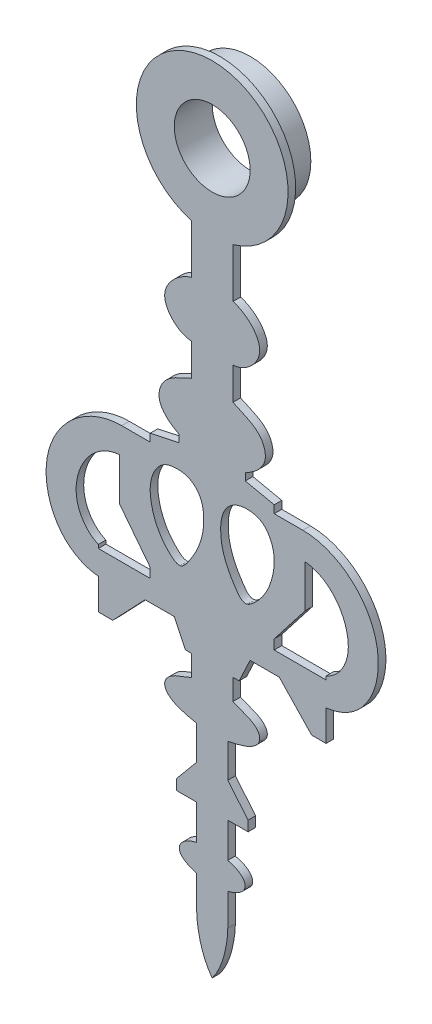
SolidWorks part; units mm, degrees
ref_plane "Спереди" through (0, 0, 0) normal (0, 0, 1) x (1, 0, 0)
ref_plane "Сверху" through (0, 0, 0) normal (0, 1, 0) x (1, 0, 0)
ref_plane "Справа" through (0, 0, 0) normal (1, 0, 0) x (0, 0, -1)
sketch "Эскиз1" plane through (0, 0, 0) normal (0, 0, 1) x (1, 0, 0)
  line L0 (2.735, 26.3813) -> (2.735, 32.8813)
  line L1 (2.05, -45.5133) -> (2.05, -41.28)
  line L2 (2.05, -37.7522) -> (2.05, -33.1537)
  line L3 (2.05, -33.1537) -> (4.7311, -33.1537)
  line L4 (4.7311, -33.1537) -> (4.7311, -31.8131)
  line L5 (4.7311, -31.8131) -> (2.05, -28.6028)
  line L6 (2.05, -28.6028) -> (2.05, -24.1578)
  line L7 (15.0106, -17.9279) -> (15.0106, -13.8567)
  line L8 (13.1058, -17.9279) -> (15.0106, -17.9279)
  line L9 (8.8372, -13.4476) -> (13.1058, -17.9279)
  line L10 (4.9919, -13.4476) -> (8.8372, -13.4476)
  line L11 (2.735, -16.5168) -> (3.5455, -16.5168)
  line L12 (3.5455, -16.5168) -> (4.9919, -13.4476)
  line L13 (2.735, -19.2684) -> (2.735, -16.5168)
  line L14 (11.9415, 4.8758) -> (8.1668, 4.8758)
  line L15 (8.1668, 4.8758) -> (8.1668, 5.8988)
  line L16 (8.1668, 5.8988) -> (4.3568, 6.7102)
  line L17 (2.735, 14.8805) -> (2.735, 19.1305)
  line L29 (-15.0106, -10.2211) -> (-15.0106, -10.6797)
  line L30 (-15.0106, -10.6797) -> (-8.1668, -10.6797)
  line L31 (-8.1668, -10.6797) -> (-8.1668, -9.4097)
  line L32 (-8.1668, -9.4097) -> (-12.2237, -4.1886)
  line L33 (-12.2237, -4.1886) -> (-12.2237, 1.4205)
  line L62 (4.3568, 6.7102) -> (4.3568, 7.6627)
  line L63 (15.0106, -10.2211) -> (15.0106, -10.6797)
  line L64 (15.0106, -10.6797) -> (8.1668, -10.6797)
  line L65 (8.1668, -10.6797) -> (8.1668, -9.4097)
  line L66 (8.1668, -9.4097) -> (12.2237, -4.1886)
  line L67 (12.2237, -4.1886) -> (12.2237, 1.4205)
  line L204 (-2.05, -45.5133) -> (-2.05, -41.28)
  line L218 (-2.05, -37.7522) -> (-2.05, -33.1537)
  line L219 (-2.05, -33.1537) -> (-4.7311, -33.1537)
  line L220 (-4.7311, -33.1537) -> (-4.7311, -31.8131)
  line L221 (-4.7311, -31.8131) -> (-2.05, -28.6028)
  line L222 (-2.05, -28.6028) -> (-2.05, -24.1578)
  line L240 (-2.735, -19.2684) -> (-2.735, -16.5168)
  line L241 (-2.735, -16.5168) -> (-3.5455, -16.5168)
  line L242 (-3.5455, -16.5168) -> (-4.9919, -13.4476)
  line L243 (-4.9919, -13.4476) -> (-8.8372, -13.4476)
  line L244 (-8.8372, -13.4476) -> (-13.1058, -17.9279)
  line L245 (-13.1058, -17.9279) -> (-15.0106, -17.9279)
  line L246 (-15.0106, -17.9279) -> (-15.0106, -13.8567)
  line L264 (-11.9415, 4.8758) -> (-8.1668, 4.8758)
  line L265 (-8.1668, 4.8758) -> (-8.1668, 5.8988)
  line L266 (-8.1668, 5.8988) -> (-4.3568, 6.7102)
  line L267 (-4.3568, 6.7102) -> (-4.3568, 7.6627)
  line L284 (-2.735, 14.8805) -> (-2.735, 19.1305)
  line L301 (-2.735, 26.3813) -> (-2.735, 32.8813)
  line L302 (0, 52.3428) -> (0, -68.9607) construction
  line L303 (-18.4856, 42.5) -> (16.51, 42.5) construction
  circle A0 centre (0, 42.5) radius 5
  arc A1 (2.6811, 32.8661) -> (-2.735, 32.8813) centre (0, 42.5) ccw
  spline S0 degree 3 poles (0, -52.2) (-0.705, -51.2673) (-1.4242, -49.6376) (-1.9167, -47.3109) (-2.05, -46.1314) (-2.05, -45.5133) knots 0 0 0 0 0.490623 0.745278 1 1 1 1
  spline S1 degree 3 poles (0, -52.2) (0.705, -51.2673) (1.4242, -49.6376) (1.9167, -47.3109) (2.05, -46.1314) (2.05, -45.5133) knots 0 0 0 0 0.490623 0.745278 1 1 1 1
  spline S2 degree 3 poles (-2.05, -37.7522) (-2.7378, -37.9163) (-3.7155, -38.2464) (-4.4087, -39.3011) (-4.2674, -40.1132) (-3.3947, -40.8274) (-2.6053, -41.1399) (-2.05, -41.28) knots 0 0 0 0 0.353501 0.472037 0.582771 0.721162 1 1 1 1
  spline S3 degree 3 poles (2.05, -37.7522) (2.7378, -37.9163) (3.7155, -38.2464) (4.4087, -39.3011) (4.2674, -40.1132) (3.3947, -40.8274) (2.6053, -41.1399) (2.05, -41.28) knots 0 0 0 0 0.353501 0.472037 0.582771 0.721162 1 1 1 1
  spline S4 degree 3 poles (-2.735, -19.2684) (-3.6998, -19.7572) (-5.1677, -19.9802) (-6.255, -21.2601) (-6.3047, -22.1147) (-5.7416, -22.8586) (-4.3361, -23.6898) (-2.9936, -23.9594) (-2.05, -24.1578) knots 0 0 0 0 0.338644 0.424709 0.497744 0.584733 0.698034 1 1 1 1
  spline S5 degree 3 poles (2.735, -19.2684) (3.6998, -19.7572) (5.1677, -19.9802) (6.255, -21.2601) (6.3047, -22.1147) (5.7416, -22.8586) (4.3361, -23.6898) (2.9936, -23.9594) (2.05, -24.1578) knots 0 0 0 0 0.338644 0.424709 0.497744 0.584733 0.698034 1 1 1 1
  spline S6 degree 3 poles (-11.9415, 4.8758) (-14.3413, 4.8758) (-18.954, 2.9008) (-23.691, -5.5238) (-20.176, -13.299) (-15.0106, -13.8567) knots 0 0 0 0 0.259028 0.50866 1 1 1 1
  spline S7 degree 3 poles (11.9415, 4.8758) (14.3413, 4.8758) (18.954, 2.9008) (23.691, -5.5238) (20.176, -13.299) (15.0106, -13.8567) knots 0 0 0 0 0.259028 0.50866 1 1 1 1
  spline S8 degree 3 poles (-12.2237, 1.4205) (-13.9926, 1.2917) (-16.2843, -0.2884) (-17.7901, -3.4283) (-18.2062, -6.961) (-16.694, -9.4784) (-15.0106, -10.2211) knots 0 0 0 0 0.330322 0.496738 0.660859 1 1 1 1
  spline S9 degree 3 poles (12.2237, 1.4205) (13.9926, 1.2917) (16.2843, -0.2884) (17.7901, -3.4283) (18.2062, -6.961) (16.694, -9.4784) (15.0106, -10.2211) knots 0 0 0 0 0.330322 0.496738 0.660859 1 1 1 1
  spline S10 degree 3 poles (-2.8111, 3.4035) (-4.6373, 3.7171) (-6.4816, 3.3839) (-7.8058, 1.8033) (-8.311, -0.2681) (-7.8764, -3.3078) (-6.6984, -5.6735) (-4.2271, -7.7527) (-1.9391, -4.6974) (-0.8281, -1.7021) (-1.3184, 1.8724) (-2.8111, 3.4035) (-4.6373, 3.7171) (-6.4816, 3.3839) knots -0.215228 -0.127236 -0.064692 0 0.064975 0.126684 0.209139 0.28798 0.448635 0.508668 0.568592 0.784772 0.872764 0.935308 1 1.064975 1.126684 1.209139 only from (-4.639, 3.6078) to (-4.639, 3.6078)
  spline S11 degree 3 poles (2.8111, 3.4035) (4.6373, 3.7171) (6.4816, 3.3839) (7.8058, 1.8033) (8.311, -0.2681) (7.8764, -3.3078) (6.6984, -5.6735) (4.2271, -7.7527) (1.9391, -4.6974) (0.8281, -1.7021) (1.3184, 1.8724) (2.8111, 3.4035) (4.6373, 3.7171) (6.4816, 3.3839) knots -0.215228 -0.127236 -0.064692 0 0.064975 0.126684 0.209139 0.28798 0.448635 0.508668 0.568592 0.784772 0.872764 0.935308 1 1.064975 1.126684 1.209139 only from (4.639, 3.6078) to (4.639, 3.6078)
  spline S12 degree 3 poles (-2.735, 19.1305) (-4.357, 19.1509) (-8.2402, 22.6829) (-4.2072, 26.0435) (-2.735, 26.3813) knots 0 0 0 0 0.492044 1 1 1 1
  spline S13 degree 3 poles (2.735, 19.1305) (4.357, 19.1509) (8.2402, 22.6829) (4.2072, 26.0435) (2.735, 26.3813) knots 0 0 0 0 0.492044 1 1 1 1
  spline S14 degree 3 poles (-4.3568, 7.6627) (-5.1708, 8.0838) (-6.298, 8.8408) (-7.0585, 10.3754) (-6.9872, 11.5207) (-6.5161, 12.6188) (-5.1201, 13.9335) (-3.672, 14.4144) (-2.735, 14.8805) knots 0 0 0 0 0.262865 0.368854 0.468954 0.577987 0.700614 1 1 1 1
  spline S15 degree 3 poles (4.3568, 7.6627) (5.1708, 8.0838) (6.298, 8.8408) (7.0585, 10.3754) (6.9872, 11.5207) (6.5161, 12.6188) (5.1201, 13.9335) (3.672, 14.4144) (2.735, 14.8805) knots 0 0 0 0 0.262865 0.368854 0.468954 0.577987 0.700614 1 1 1 1
  dimension "D1" = 10
  dimension "D2" = 20
  dimension "D3" = 6.5
  dimension "D4" = 94.7
  dimension "D5" = 4.25
  dimension "D6" = 42.5
  dimension "D7" = 2.735
  dimension "D8" = 2.05
extrude "Бобышка-Вытянуть1" add sketch "Эскиз1" along normal blind 1
sketch "Эскиз2" plane through (0, 0, 0) normal (0, 0, -1) x (-1, 0, 0)
  circle A0 centre (0, 42.5) radius 8
  circle A1 centre (0, 42.5) radius 5 construction
  circle A2 centre (0, 42.5) radius 5
  dimension "D1" = 16
extrude "Бобышка-Вытянуть2" add sketch "Эскиз2" along normal blind 4
